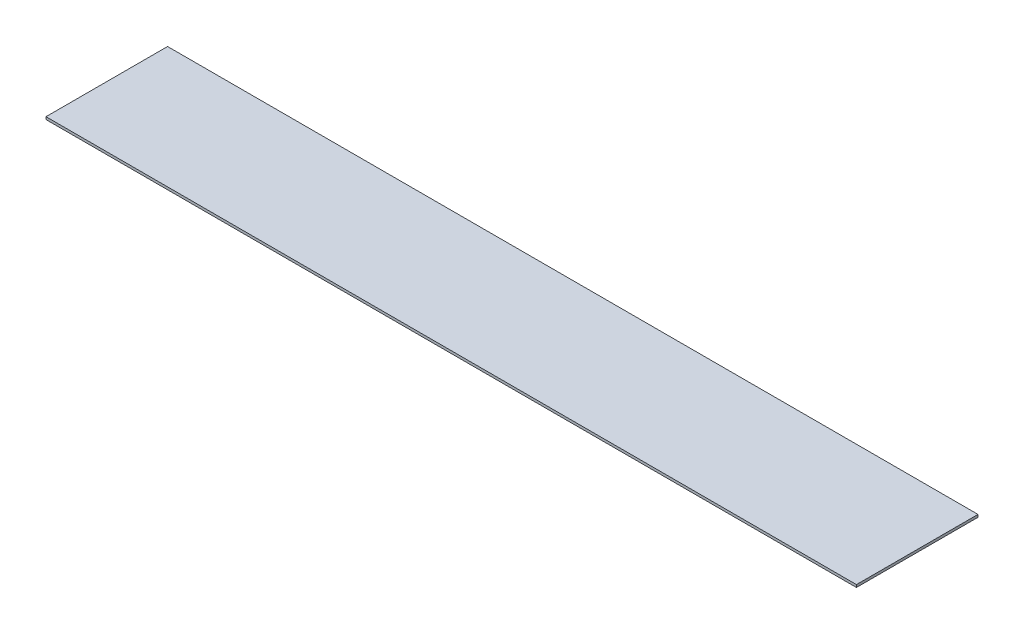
SolidWorks part; units mm, degrees
ref_plane "Front Plane" through (0, 0, 0) normal (0, 0, 1) x (1, 0, 0)
ref_plane "Top Plane" through (0, 0, 0) normal (0, 1, 0) x (1, 0, 0)
ref_plane "Right Plane" through (0, 0, 0) normal (1, 0, 0) x (0, 0, -1)
sketch "Sketch1" plane through (0, 0, 0) normal (0, 1, 0) x (1, 0, 0)
  line L1 (-1016, -152.4) -> (1016, -152.4)
  line L2 (-1016, -152.4) -> (-1016, 152.4)
  line L3 (-1016, 152.4) -> (1016, 152.4)
  line L4 (1016, -152.4) -> (1016, 152.4)
  line L5 (-1016, -152.4) -> (1016, 152.4) construction
  line L6 (-1016, 152.4) -> (1016, -152.4) construction
  point P0 (0, 0)
  dimension "D1" = 2032
  dimension "D2" = 304.8
extrude "Extrude1" add sketch "Sketch1" along normal mid plane 6.35
